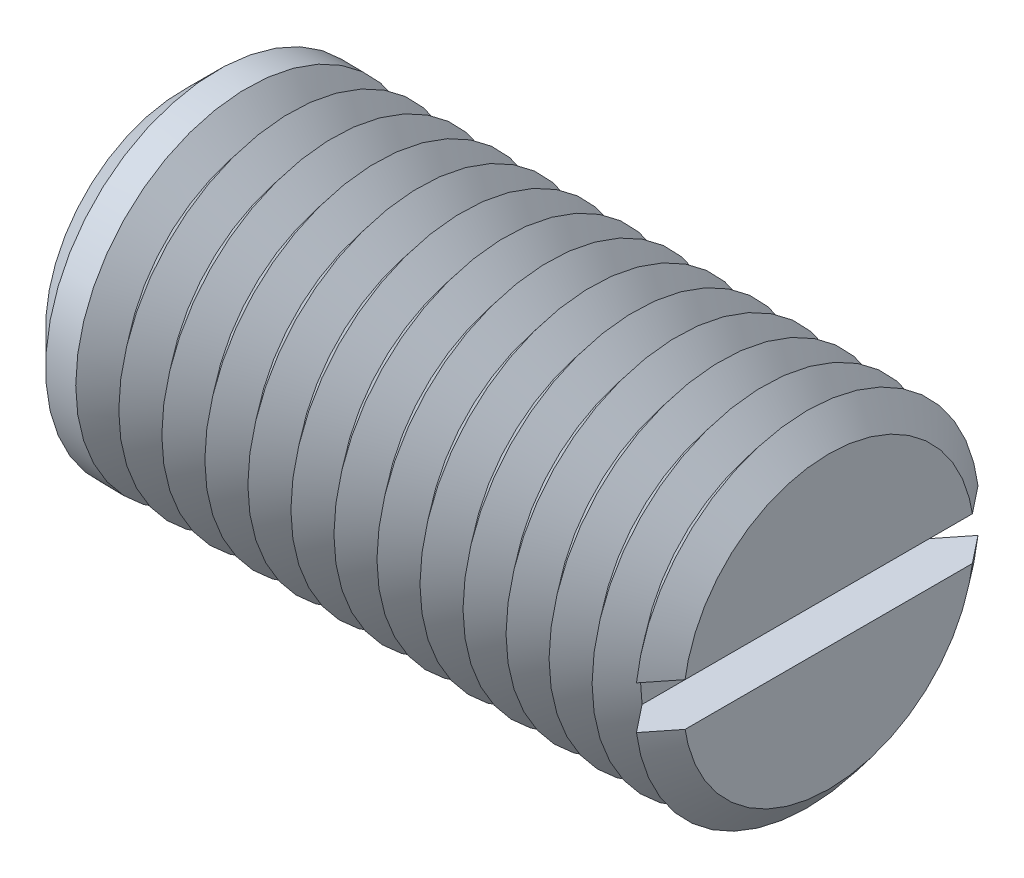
SolidWorks part; units mm, degrees
ref_plane "Front Plane" through (0, 0, 0) normal (0, 0, 1) x (1, 0, 0)
ref_plane "Top Plane" through (0, 0, 0) normal (0, 1, 0) x (1, 0, 0)
ref_plane "Right Plane" through (0, 0, 0) normal (1, 0, 0) x (0, 0, -1)
sketch "Sketch1" plane through (0, 0, 0) normal (1, 0, 0) x (0, 0, -1)
  circle A0 centre (0, 0) radius 8
  dimension "D1" = 16
extrude "Extrude1" add sketch "Sketch1" along normal mid plane 30
sketch "Sketch2" plane through (0, 0, 0) normal (0, 0, 1) x (1, 0, 0)
  line L0 (15, 1) -> (13, 1)
  line L1 (15, -8) -> (15, 8) construction
  line L2 (13, 1) -> (13, -1)
  line L3 (0, 0) -> (50000, 0) construction
  line L4 (15, -1) -> (13, -1)
  line L5 (15, -1) -> (15, 1)
  point P9 (13, 0)
  dimension "D1" = 2
extrude "Extrude2" cut sketch "Sketch2" against normal mid plane 24
chamfer "Chamfer1" distance 1.6 angle 45 1 edges at (-15, 0, -8)
sketch "Sketch3" plane through (0, 0, 0) normal (0, 0, 1) x (1, 0, 0)
  line L0 (0, 0) -> (30.9602, 0) construction
  line L1 (14, -8) -> (16, -8)
  line L2 (-13.4, -8) -> (15, -8) construction
  line L3 (16, -8) -> (15, -6.751)
  line L4 (15, -8) -> (15, -1) construction
  line L5 (15, -6.751) -> (14, -8)
  dimension "D1" = 2
  dimension "D2" = 1.6
revolve "Cut-Revolve1" cut sketch "Sketch3" angle 360 about L0
pattern_linear "LPattern1" count 14 spacing 2 along (-1, 0, 0) of "Cut-Revolve1"
equation "\"D2@Sketch3\" = \"D1@Sketch3\"*0.8"
